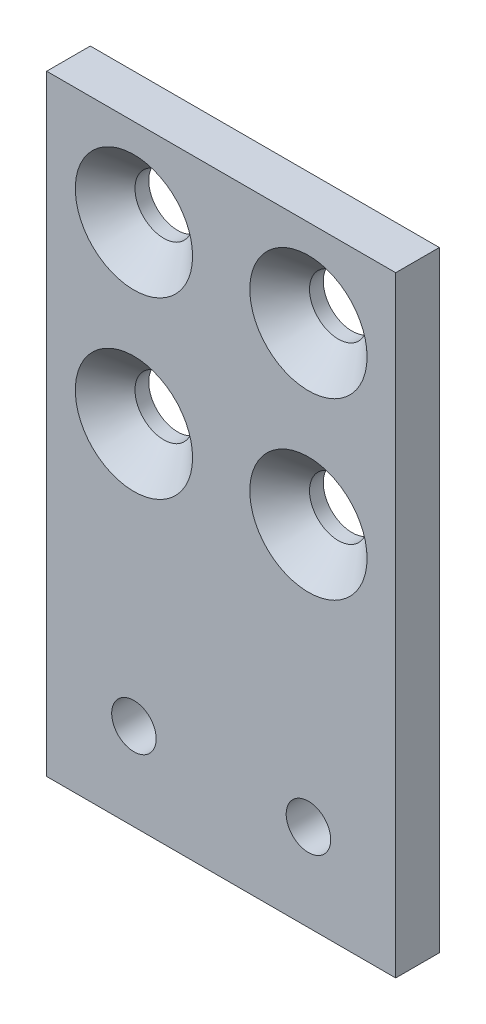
SolidWorks part; units mm, degrees
ref_plane "Front Plane" through (0, 0, 0) normal (0, 0, 1) x (1, 0, 0)
ref_plane "Top Plane" through (0, 0, 0) normal (0, 1, 0) x (1, 0, 0)
ref_plane "Right Plane" through (0, 0, 0) normal (1, 0, 0) x (0, 0, -1)
sketch "Sketch1" plane through (0, 0, 0) normal (0, 0, 1) x (1, 0, 0)
  line L1 (-89.4885, 19.05) -> (-49.4885, 19.05)
  line L2 (-89.4885, 19.05) -> (-89.4885, -50.95)
  line L3 (-89.4885, -50.95) -> (-49.4885, -50.95)
  line L4 (-49.4885, 19.05) -> (-49.4885, -50.95)
  dimension "D1" = 40
  dimension "D2" = 70
extrude "Extrude1" add sketch "Sketch1" along normal blind 5
hole_wizard "CSK for M6 SFHCS1" positions "Sketch3" profile "Sketch2" countersink size "M6" standard "Ansi Metric"
sketch "Sketch3" plane through (0, 0, 5) normal (0, 0, 1) x (1, 0, 0)
  line L0 (-49.4885, 19.05) -> (-89.4885, 19.05) construction
  line L1 (-49.4885, -50.95) -> (-49.4885, 19.05) construction
  point P0 (-59.4885, 9.05)
  point P1 (-79.4885, 9.05)
  point P6 (-59.4885, -10.95)
  point P7 (-79.4885, -10.95)
  dimension "D1" = 20
  dimension "D2" = 10
  dimension "D3" = 10
  dimension "D4" = 20
sketch "Sketch2" plane through (-59.4885, 9.05, 5) normal (1, 0, 0) x (0, -1, 0)
  line L0 (0, 0) -> (0, 5)
  line L1 (0, 5) -> (3.3, 5)
  line L2 (3.3, 5) -> (3.3, 3.42)
  line L3 (3.3, 3.42) -> (6.72, 0)
  line L5 (6.72, 0) -> (0, 0)
  line L6 (-3.3, 3.42) -> (-6.72, 0) construction
  line L11 (0, -6.35) -> (0, 107.95) construction
  dimension "Thru Hole Dia." = 6.6
  dimension "Thru Hole Depth" = 5
  dimension "Near C'Sink Dia." = 13.44
  dimension "Near C'Sink Angle" = 90
hole_wizard "M5.1 (5.1) Diameter Hole1" positions "Sketch5" profile "Sketch4" hole size "M5.1" standard "Ansi Metric"
sketch "Sketch5" plane through (0, 0, 5) normal (0, 0, 1) x (1, 0, 0)
  line L0 (-49.4885, -50.95) -> (-49.4885, 19.05) construction
  line L1 (-89.4885, -50.95) -> (-49.4885, -50.95) construction
  point P0 (-79.4885, -40.95)
  point P1 (-59.4885, -40.95)
  dimension "D1" = 20
  dimension "D2" = 10
  dimension "D3" = 10
sketch "Sketch4" plane through (-79.4885, -40.95, 5) normal (1, 0, 0) x (0, -1, 0)
  line L0 (0, 0) -> (0, 11.5322)
  line L1 (0, 11.5322) -> (2.55, 10)
  line L2 (2.55, 10) -> (2.55, 0)
  line L5 (2.55, 0) -> (0, 0)
  line L10 (0, 11.5322) -> (-2.55, 10) construction
  line L11 (0, -6.35) -> (0, 107.95) construction
  dimension "Hole Dia." = 5.1
  dimension "Hole Depth" = 10
  dimension "Drill Angle" = 118
